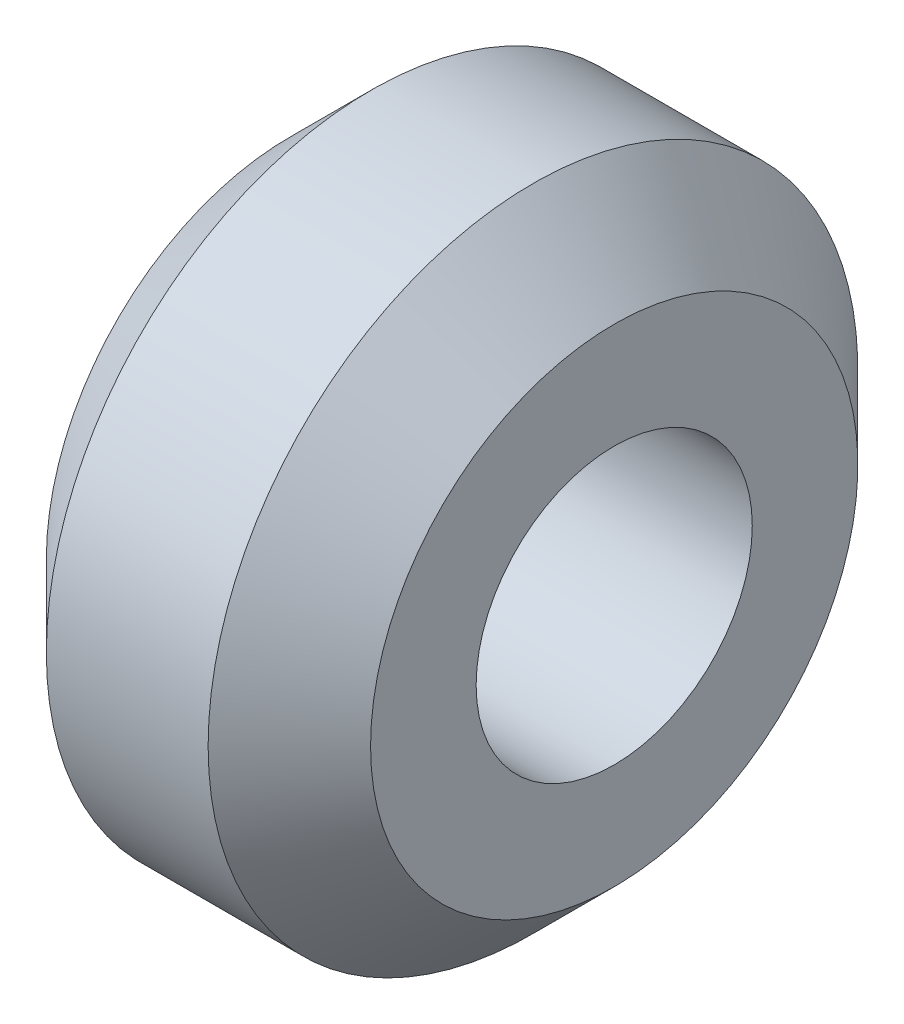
SolidWorks part; units mm, degrees
ref_plane "Plan1" through (0, 0, 0) normal (0, 0, 1) x (1, 0, 0)
ref_plane "Plan2" through (0, 0, 0) normal (0, 1, 0) x (1, 0, 0)
ref_plane "Plan3" through (0, 0, 0) normal (1, 0, 0) x (0, 0, -1)
sketch "Esquisse1" plane through (0, 0, 0) normal (0, 0, 1) x (1, 0, 0)
  line L0 (-50, 0) -> (50, 0) construction
  line L1 (11.01, 10) -> (15.99, 10)
  line L2 (15.99, 10) -> (18.49, 7.5)
  line L3 (18.49, 7.5) -> (18.49, 4.25)
  line L4 (13.5, 21.5) -> (13.5, -14.1413) construction
  line L5 (11.01, 10) -> (8.51, 7.5)
  line L6 (8.51, 7.5) -> (8.51, 4.25)
  line L10 (8.51, 4.25) -> (18.49, 4.25)
  point P10 (13.5, 10)
  point P13 (8.51, 0)
  point P16 (18.49, 0)
  dimension "D1" = 4.25
  dimension "D2" = 9.98
  dimension "D3" = 10
  dimension "D5" = 7.5
revolve "Base-Révolution" add sketch "Esquisse1" angle 360 about L0
